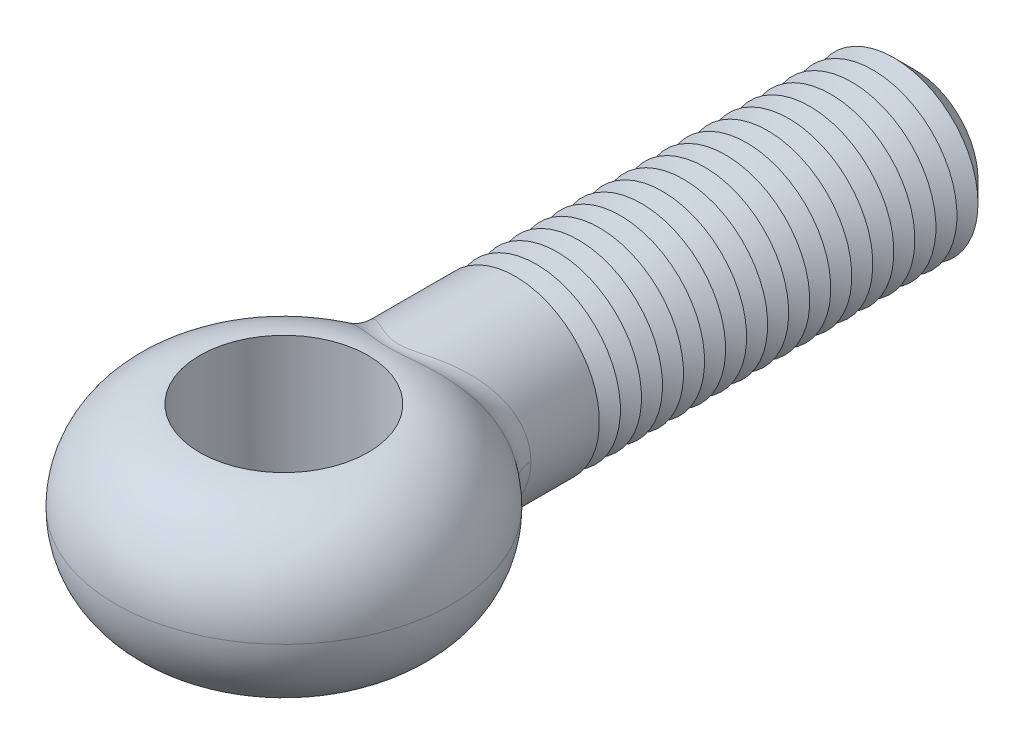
SolidWorks part; units mm, degrees
ref_plane "Front Plane" through (0, 0, 0) normal (0, 0, 1) x (1, 0, 0)
ref_plane "Top Plane" through (0, 0, 0) normal (0, 1, 0) x (1, 0, 0)
ref_plane "Right Plane" through (0, 0, 0) normal (1, 0, 0) x (0, 0, -1)
sketch "Sketch7" plane through (0, 0, 0) normal (0, 1, 0) x (1, 0, 0)
  circle A0 centre (0, 0) radius 16
  dimension "D1" = 32
extrude "Boss-Extrude3" add sketch "Sketch7" along normal mid plane 17
sketch "Sketch8" plane through (0, 0, 0) normal (0, 0, 1) x (1, 0, 0)
  circle A0 centre (0, 0) radius 8
  dimension "D1" = 16
extrude "Boss-Extrude4" add sketch "Sketch8" against normal blind 60
fillet "Fillet5" radius 8.5 2 edges at (0, -8.5, 16) (0, 8.5, 16)
fillet "Fillet6" radius 3 2 edges at (-0.1803, -7.998, -10.3764) (0.1803, 7.998, -10.3764)
chamfer "Chamfer1" distance 2 angle 45 1 edges at (8, 0, -60)
sketch "Sketch10" plane through (0, 0, 0) normal (0, 1, 0) x (1, 0, 0)
  line L0 (0, 28.1405) -> (0, -7.9233) construction
sketch "Sketch11" plane through (0, 0, 0) normal (0, 1, 0) x (1, 0, 0)
  line L0 (-8, 22) -> (-6.2679, 23)
  line L1 (-8, 58) -> (-8, 15.4919) construction
  line L2 (-6.2679, 23) -> (-8, 24)
  line L3 (-8, 24) -> (-8, 22)
  line L4 (6, 60) -> (-6, 60) construction
  dimension "D1" = 2
  dimension "D2" = 38
revolve "Cut-Revolve1" cut sketch "Sketch11" angle 360 about L0
pattern_linear "LPattern1" count 18 spacing 2 along (0, 0, -1) of "Cut-Revolve1"
sketch "Sketch12" plane through (0, 0, 0) normal (0, 1, 0) x (1, 0, 0)
  circle A0 centre (0, 0) radius 8
  dimension "D1" = 16
extrude "Cut-Extrude1" cut sketch "Sketch12" against normal mid plane 17
